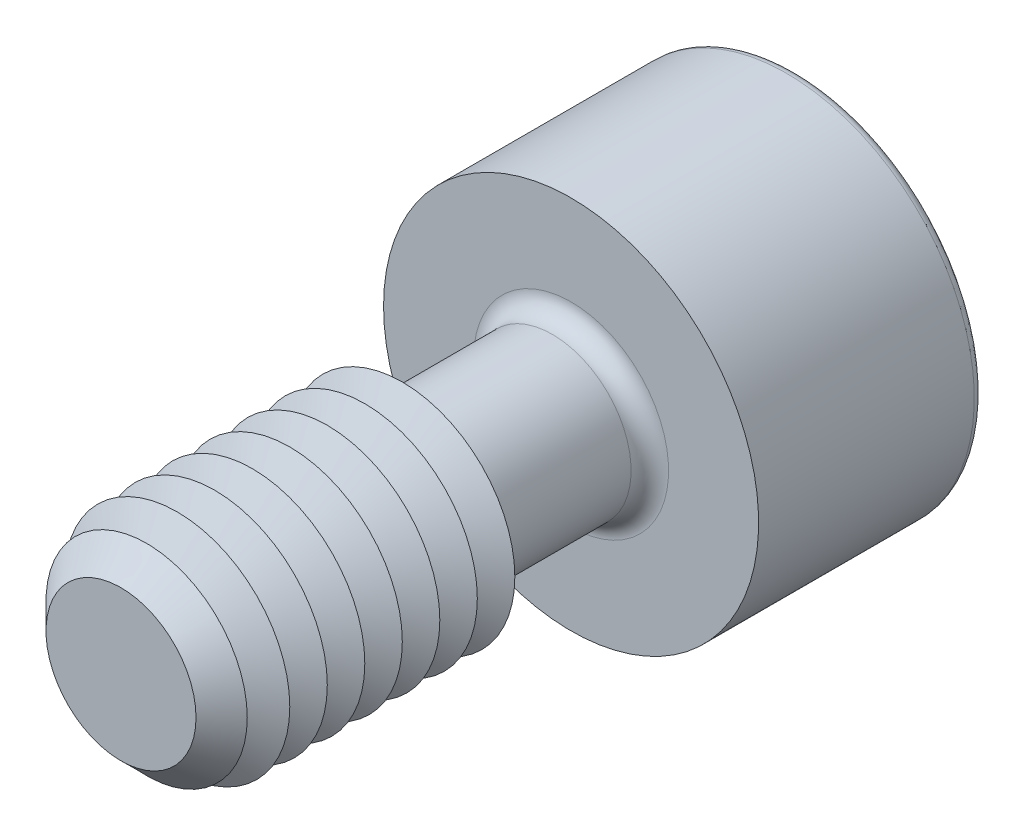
SolidWorks part; units mm, degrees
ref_plane "Front Plane" through (0, 0, 0) normal (0, 0, 1) x (1, 0, 0)
ref_plane "Top Plane" through (0, 0, 0) normal (0, 1, 0) x (1, 0, 0)
ref_plane "Right Plane" through (0, 0, 0) normal (1, 0, 0) x (0, 0, -1)
sketch "Sketch1" plane through (0, 0, 0) normal (0, 0, 1) x (1, 0, 0)
  circle A0 centre (0, 0) radius 2.1
  dimension "D1" = 4.2
extrude "Extrude1" add sketch "Sketch1" along normal mid plane 12
sketch "Sketch2" plane through (0, 0, 0) normal (1, 0, 0) x (0, 0, -1)
  line L0 (-6, 0) -> (-6, 3)
  line L1 (-6, 2.1) -> (-6, -2.1) construction
  line L2 (-6, 3) -> (1.5, 3)
  line L3 (1.5, 3) -> (2.0196, 2.1)
  line L4 (6, 2.1) -> (-6, 2.1) construction
  line L5 (2.0196, 2.1) -> (2.0196, 0)
  line L6 (2.0196, 0) -> (-6, 0)
  dimension "D1" = 3
  dimension "D2" = 120
  dimension "D3" = 7.5
revolve "Revolve1" add sketch "Sketch2" angle 360 about L6
chamfer "Chamfer1" distance 1 angle 45 1 edges at (0, 3, 6)
sketch "Sketch3" plane through (0, 0, -6) normal (0, 0, -1) x (-1, 0, 0)
  circle A0 centre (0, 0) radius 5
  dimension "D1" = 10
extrude "Extrude2" add sketch "Sketch3" along normal blind 6
sketch "Sketch4" plane through (-13.7, 0, -12) normal (0, 0, 1) x (1, 0, 0)
  line L2 (12.2566, -2.5) -> (15.1434, -2.5)
  line L3 (15.1434, -2.5) -> (16.5868, 0)
  line L4 (16.5868, 0) -> (15.1434, 2.5)
  line L6 (15.1434, 2.5) -> (12.2566, 2.5)
  line L7 (12.2566, 2.5) -> (10.8132, 0)
  line L8 (10.8132, 0) -> (12.2566, -2.5)
  circle A0 centre (13.7, 0) radius 2.5 construction
  dimension "D1" = 5
extrude "Extrude3" cut sketch "Sketch4" along normal blind 5
fillet "Fillet1" radius 0.5 1 edges at (-2.1, 0, -6)
fillet "Fillet2" radius 0.25 1 edges at (-5, 0, -12)
sketch "Sketch5" plane through (0, 0, 0) normal (1, 0, 0) x (0, 0, -1)
  line L0 (7, 0) -> (7, -2.5)
  line L1 (7, -2.5) -> (5.5566, 0)
  line L2 (5.5566, 0) -> (7, 0)
  dimension "D1" = 30
revolve "Cut-Revolve1" cut sketch "Sketch5" angle 360 about L2
sketch "Sketch6" plane through (0, 0, 0) normal (1, 0, 0) x (0, 0, -1)
  line L0 (1.332, 0) -> (-13.289, 0) construction
sketch "Sketch7" plane through (0, 0, 0) normal (1, 0, 0) x (0, 0, -1)
  line L0 (1.5, 3) -> (1, 2.134)
  line L1 (1, 2.134) -> (0.5, 3)
  line L2 (1.5, 3) -> (-5, 3) construction
  line L3 (0.5, 3) -> (1.5, 3)
  dimension "D1" = 1
revolve "Cut-Revolve2" cut sketch "Sketch7" angle 360 about L0
pattern_linear "LPattern1" count 7 spacing 1 along (0, 0, 1) of "Cut-Revolve2"
